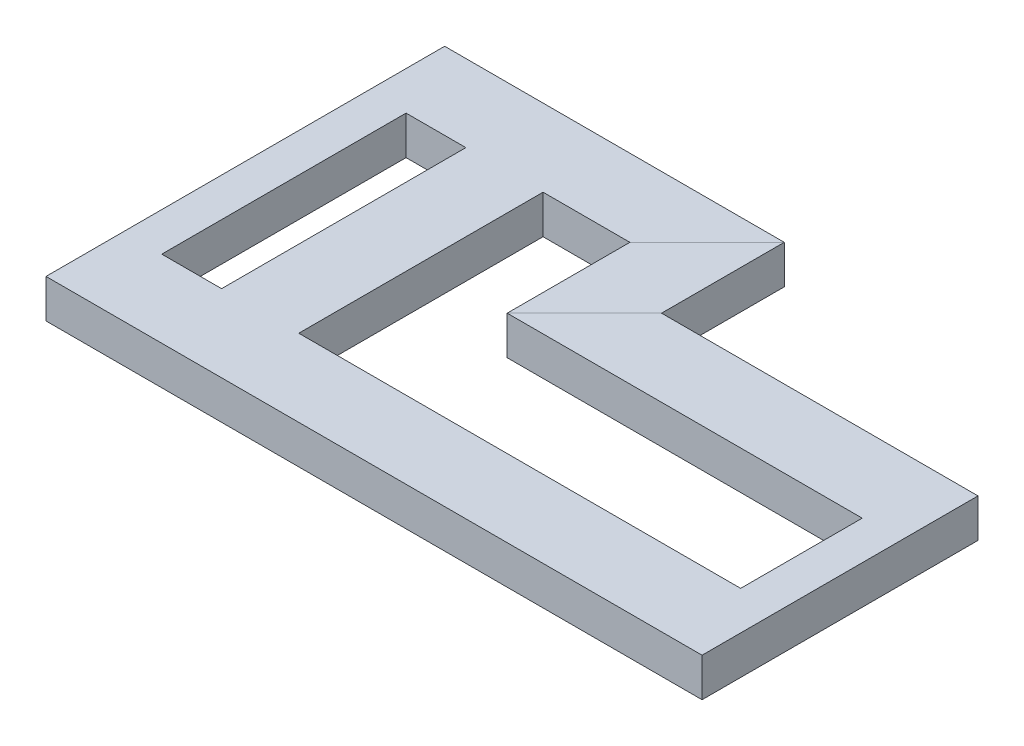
SolidWorks part; units mm, degrees
ref_plane "Front Plane" through (0, 0, 0) normal (0, 0, 1) x (1, 0, 0)
ref_plane "Top Plane" through (0, 0, 0) normal (0, 1, 0) x (1, 0, 0)
ref_plane "Right Plane" through (0, 0, 0) normal (1, 0, 0) x (0, 0, -1)
sketch "Sketch8" plane through (0, 0, 0) normal (1, 0, 0) x (0, 0, -1)
  line L0 (-90, -100) -> (-90, -10)
  line L1 (-90, -10) -> (90, -10)
  line L2 (-100, -100) -> (-100, 0)
  line L3 (-100, 0) -> (100, 0)
  line L4 (100, -100) -> (100, 0)
  line L5 (90, -100) -> (90, -10)
  line L6 (-100, -100) -> (-90, -100)
  line L7 (100, -100) -> (90, -100)
  dimension "D1" = 10
  dimension "D2" = 200
  dimension "D3" = 100
extrude "Boss-Extrude1" add sketch "Sketch8" against normal blind 1700
sketch "Sketch9" plane through (0, 0, 0) normal (1, 0, 0) x (0, 0, -1)
  line L0 (415, -100) -> (415, 0)
  line L1 (415, 0) -> (615, 0)
  line L2 (615, 0) -> (615, -100)
  line L3 (425, -100) -> (425, -10)
  line L4 (425, -10) -> (605, -10)
  line L5 (605, -10) -> (605, -100)
  line L6 (415, -100) -> (425, -100)
  line L7 (605, -100) -> (615, -100)
  line L8 (-100, 0) -> (-100, -100) construction
  dimension "D1" = 200
  dimension "D2" = 100
  dimension "D4" = 715
  dimension "D3" = 10
sketch "Sketch10" plane through (0, 0, 0) normal (0, 1, 0) x (1, 0, 0)
  line L0 (0, 615) -> (-820, 615)
  line L2 (-820, 615) -> (-820, 933)
  line L3 (-820, 933) -> (-1700, 933)
  line L5 (-1700, 100) -> (-1700, -100) construction
  line L6 (-1700, -100) -> (0, -100) construction
  dimension "D1" = 1033
  dimension "D2" = 820
sweep "Sweep1" add profiles "Sketch9" path "Sketch10"
sketch "Sketch12" plane through (0, 0, -733) normal (0, 0, -1) x (-1, 0, 0)
  line L0 (1610, -10) -> (1690, -10)
  line L1 (1600, 0) -> (1700, 0)
  line L2 (1600, 0) -> (1600, -100)
  line L3 (1600, -100) -> (1700, -100)
  line L4 (1700, 0) -> (1700, -100)
  line L5 (1690, -10) -> (1690, -90)
  line L6 (1610, -90) -> (1690, -90)
  line L7 (1610, -10) -> (1610, -90)
  line L8 (1700, 0) -> (1700, -100) construction
  line L9 (1020, -100) -> (1700, -100) construction
  line L10 (1020, 0) -> (1700, 0) construction
  dimension "D1" = 100
  dimension "D2" = 10
extrude "Boss-Extrude2" add sketch "Sketch12" against normal up to surface (633 mm away)
sketch "Sketch13" plane through (0, 0, -415) normal (0, 0, 1) x (1, 0, 0)
  line L0 (0, 0) -> (-1020, 0) construction
  line L1 (0, -100) -> (-100, -100)
  line L2 (0, -100) -> (0, 0)
  line L3 (0, 0) -> (-100, 0)
  line L4 (-100, -100) -> (-100, 0)
  line L5 (-10, -10) -> (-90, -10)
  line L6 (-90, -90) -> (-90, -10)
  line L7 (-10, -90) -> (-90, -90)
  line L8 (-10, -90) -> (-10, -10)
  dimension "D1" = 100
  dimension "D2" = 10
extrude "Boss-Extrude3" add sketch "Sketch13" along normal up to surface (315 mm away)
sketch "Sketch14" plane through (-1700, 0, 0) normal (-1, 0, 0) x (0, 0, 1)
  line L1 (90, -100) -> (-90, -100)
  line L2 (90, -100) -> (90, -10)
  line L3 (90, -10) -> (-90, -10)
  line L4 (-90, -100) -> (-90, -10)
  line L5 (-743, -100) -> (-923, -100)
  line L6 (-743, -100) -> (-743, -10)
  line L7 (-743, -10) -> (-923, -10)
  line L8 (-923, -100) -> (-923, -10)
extrude "Boss-Extrude4" add sketch "Sketch14" against normal blind 5 contours L5 L8 L7 L6 | L1 L4 L3 L2
sketch "Sketch15" plane through (0, 0, 0) normal (1, 0, 0) x (0, 0, -1)
  line L1 (425, -100) -> (605, -100)
  line L2 (425, -100) -> (425, -10)
  line L3 (425, -10) -> (605, -10)
  line L4 (605, -100) -> (605, -10)
  line L5 (90, -10) -> (-90, -10)
  line L6 (90, -10) -> (90, -100)
  line L7 (90, -100) -> (-90, -100)
  line L8 (-90, -10) -> (-90, -100)
extrude "Boss-Extrude5" add sketch "Sketch15" against normal blind 5
sketch "Sketch16" plane through (0, 0, -100) normal (0, 0, -1) x (-1, 0, 0)
  line L0 (1445, -100) -> (1445, 0)
  line L1 (1600, -100) -> (100, -100) construction
  line L2 (1600, 0) -> (100, 0) construction
  line L3 (1445, 0) -> (1245, 0)
  line L4 (1245, 0) -> (1245, -100)
  line L5 (1435, -100) -> (1435, -10)
  line L6 (1435, -10) -> (1255, -10)
  line L7 (1255, -10) -> (1255, -100)
  line L8 (1245, -100) -> (1255, -100)
  line L9 (1435, -100) -> (1445, -100)
  line L10 (1600, -100) -> (1600, 0) construction
  dimension "D1" = 200
  dimension "D3" = 155
  dimension "D2" = 10
extrude "Boss-Extrude6" add sketch "Sketch16" along normal up to next
